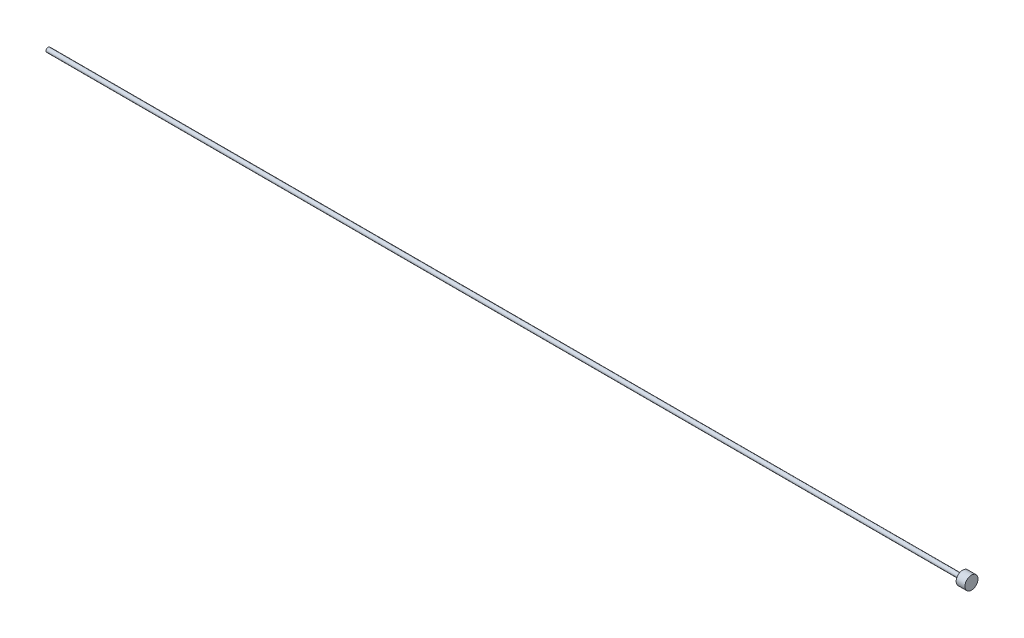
SolidWorks part; units mm, degrees
ref_plane "Front" through (0, 0, 0) normal (0, 0, 1) x (1, 0, 0)
ref_plane "Top" through (0, 0, 0) normal (0, 1, 0) x (1, 0, 0)
ref_plane "Right" through (0, 0, 0) normal (1, 0, 0) x (0, 0, -1)
sketch "Sketch2" plane through (1644.1844, 0, 0) normal (-1, 0, 0) x (0, 0, 1)
  circle A0 centre (0, 0) radius 3.175
  dimension "D1" = 6.35
extrude "Main_body" add sketch "Sketch2" along normal up to surface (1340.2945 mm away)
sketch "Sketch3" plane through (1644.1844, 0, 0) normal (-1, 0, 0) x (0, 0, 1)
  circle A0 centre (0, 0) radius 9.525
  circle A1 centre (0, 0) radius 9.525 construction
extrude "Piston Simulation" add sketch "Sketch3" along normal blind 12.7
chamfer "Chamfer1" distance 0.508 angle 45 1 edges at (303.8899, 0, 3.175)
